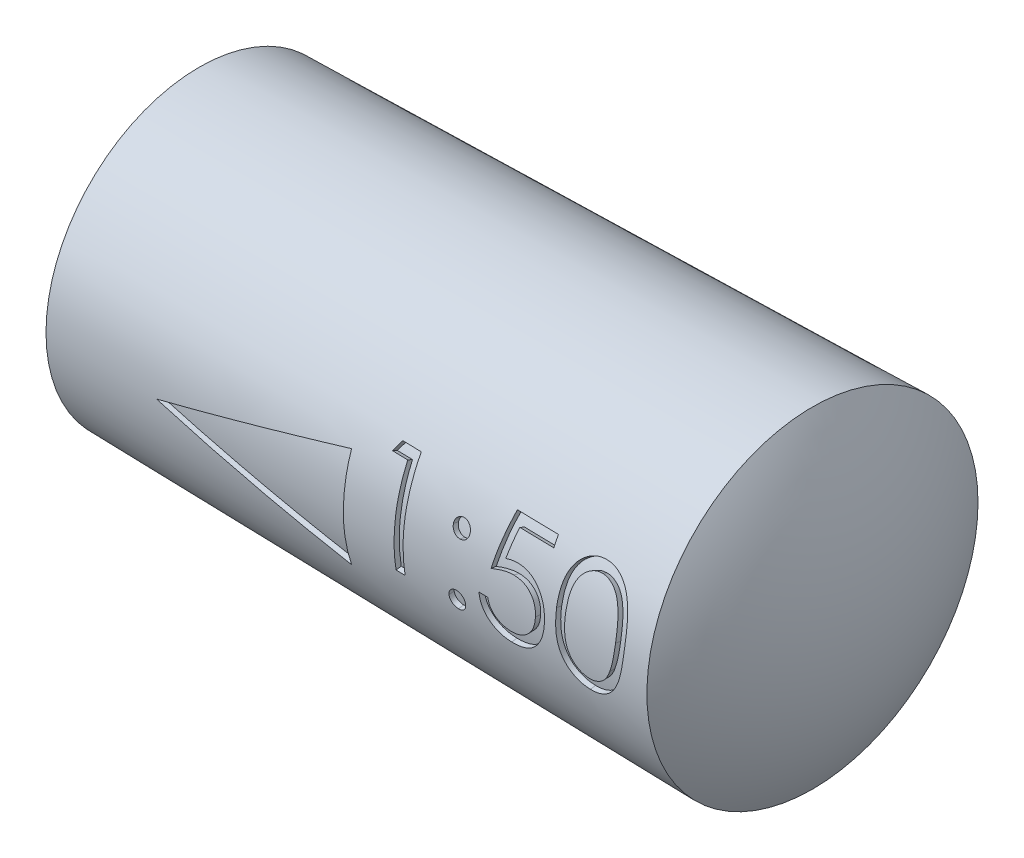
SolidWorks part; units mm, degrees
ref_plane "Front Plane" through (0, 0, 0) normal (0, 0, 1) x (1, 0, 0)
ref_plane "Top Plane" through (0, 0, 0) normal (0, 1, 0) x (1, 0, 0)
ref_plane "Right Plane" through (0, 0, 0) normal (1, 0, 0) x (0, 0, -1)
sketch "Sketch1" plane through (0, 0, 0) normal (1, 0, 0) x (0, 0, -1)
  circle A0 centre (0, 0) radius 1.5
  dimension "D1" = 3
extrude "Extrude1" add sketch "Sketch1" along normal mid plane 6
draft "Draft1" type of draft neutral plane draft angle 1.146 faces to draft 1 parameters "D1"=1.146
sketch "Sketch2" plane through (0, 0, 0) normal (0, 0, 1) x (1, 0, 0)
  line L0 (-3, 0) -> (-3, 1.5)
  line L1 (-3, 1.5) -> (-3, -1.5) construction
  line L2 (-3, 0) -> (-3.45, 0)
  line L3 (-3.45, 0) -> (-3.45, -1.56) construction
  line L4 (3, 0) -> (3, 1.62)
  line L5 (3, -1.62) -> (3, 1.62) construction
  line L6 (3, 0) -> (3.45, 0)
  line L7 (3.45, 0) -> (3.45, -1.56) construction
  line L8 (-3, -1.5) -> (3, -1.62) construction
  arc A0 (-3.45, 0) -> (-3, 1.5) centre (-0.725, 0) cw
  arc A1 (3.45, 0) -> (3, 1.62) centre (0.309, 0) ccw
  point P14 (0, -1.56)
revolve "Revolve1" add sketch "Sketch2" angle 360 about L2
sketch "Sketch5" plane through (0, 0, 0) normal (0, 0, 1) x (1, 0, 0)
  line L0 (0, 1.56) -> (0, -1.56) construction
  line L1 (3, 1.62) -> (-3, 1.5) construction
  line L2 (-3, -1.5) -> (3, -1.62) construction
ref_plane "Plane2" through (0, 0, 0) normal (-0.02, 0, 0.9998) x (0.9998, 0, 0.02)
sketch "Sketch6" plane through (0, 0, 0) normal (-0.02, 0, 0.9998) x (0.9998, 0, 0.02)
  line L0 (0, 0) -> (0, 0.5)
  line L1 (0, 1.56) -> (0, -1.56) construction
  line L2 (0, 0.5) -> (-1.866, 0)
  line L3 (-1.866, 0) -> (0, -0.5)
  line L4 (0, -0.5) -> (0, 0)
  line L5 (0, -0.25) -> (3, -0.25) construction
  text T0 "1:50" font "Century Gothic" height 1
  dimension "D1" = 1
  dimension "D2" = 30
  dimension "D3" = 3
wrap "Wrap2" sketch "Sketch6" wrap type deboss source sketch "Sketch6" thickness 0.05 parameters "D1"=0.05
equation "\"D2@Sketch2\" = \"D1@Sketch2\""
